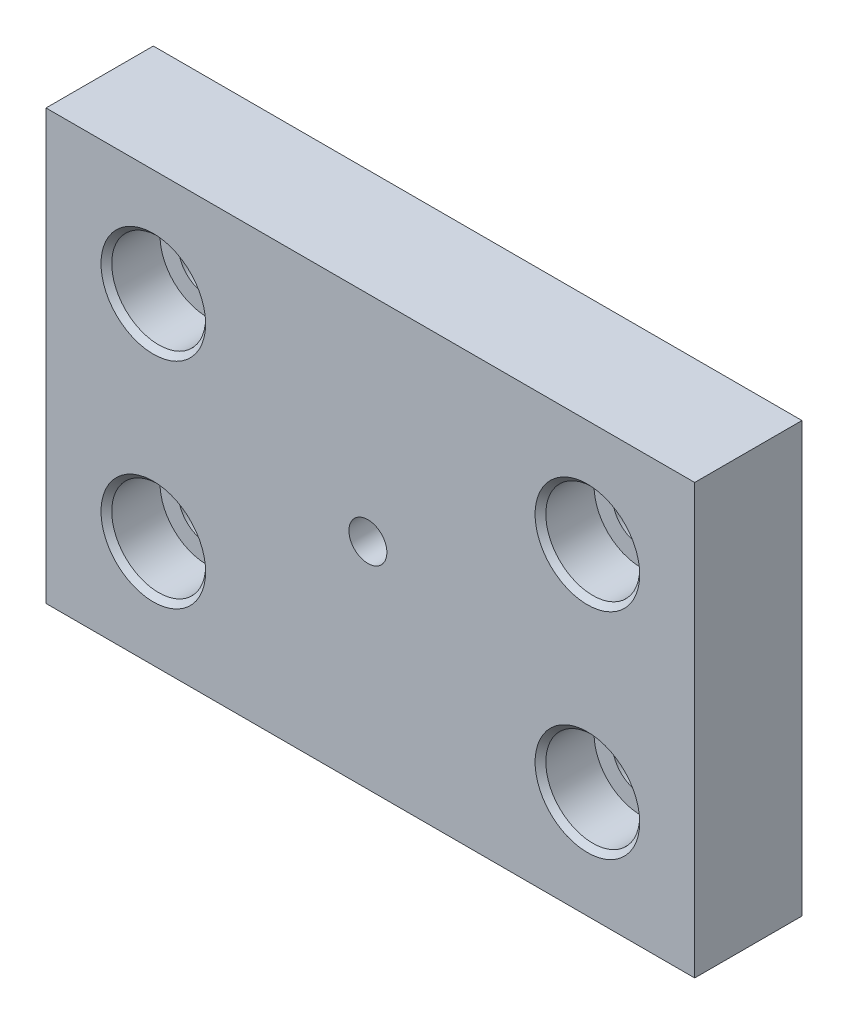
SolidWorks part; units mm, degrees
ref_plane "Front Plane" through (0, 0, 0) normal (0, 0, 1) x (1, 0, 0)
ref_plane "Top Plane" through (0, 0, 0) normal (0, 1, 0) x (1, 0, 0)
ref_plane "Right Plane" through (0, 0, 0) normal (1, 0, 0) x (0, 0, -1)
sketch "Sketch1" plane through (0, 0, 0) normal (0, 0, 1) x (1, 0, 0)
  line L1 (-57.2203, 29.3904) -> (19.5629, 29.3904)
  line L2 (-57.2203, 29.3904) -> (-57.2203, -21.4096)
  line L3 (-57.2203, -21.4096) -> (19.5629, -21.4096)
  line L4 (19.5629, 29.3904) -> (19.5629, -21.4096)
extrude "Boss-Extrude1" add sketch "Sketch1" along normal blind 12.7
hole_wizard "CBORE for 1/4 Socket Head Cap Screw1" positions "Sketch2" profile "Sketch3" counterbore size "1/4" standard "ANSI Inch"
sketch "Sketch2" plane through (0, 0, 12.7) normal (0, 0, 1) x (1, 0, 0)
  line L0 (19.5629, 29.3904) -> (-57.2203, 29.3904) construction
  line L1 (-57.2203, 29.3904) -> (-57.2203, -21.4096) construction
  line L2 (-57.2203, -21.4096) -> (19.5629, -21.4096) construction
  line L3 (19.5629, -21.4096) -> (19.5629, 29.3904) construction
  point P0 (-44.5203, 16.6904)
  point P2 (6.8629, 16.6904)
  point P4 (6.8629, -8.7096)
  point P6 (-44.5203, -8.7096)
  dimension "D1" = 12.7
  dimension "D2" = 12.7
  dimension "D3" = 12.7
  dimension "D4" = 12.7
  dimension "D5" = 12.7
  dimension "D6" = 12.7
  dimension "D7" = 12.7
  dimension "D8" = 12.7
sketch "Sketch3" plane through (-44.5203, 16.6904, 12.7) normal (1, 0, 0) x (0, -1, 0)
  line L0 (0, 0) -> (0, 12.7)
  line L1 (0, 12.7) -> (3.3782, 12.7)
  line L3 (3.3782, 12.7) -> (3.3782, 6.35)
  line L4 (5.5562, 6.35) -> (3.3782, 6.35)
  line L5 (5.5562, 6.35) -> (5.5562, 0.635)
  line L6 (5.5562, 0.635) -> (6.1912, 0)
  line L7 (6.1912, 0) -> (0, 0)
  line L8 (-5.5562, 0.635) -> (-6.1912, 0) construction
  line L11 (0, -6.35) -> (0, 107.95) construction
  dimension "Thru Hole Dia." = 6.7564
  dimension "Thru Hole Depth" = 12.7
  dimension "C'Bore Dia." = 11.1125
  dimension "C'Bore Depth" = 6.35
  dimension "Near C'Sink Dia." = 12.3825
  dimension "Near C'Sink Angle" = 90
hole_wizard "CBORE for #8 Socket Head Cap Screw1" positions "Sketch4" profile "Sketch5" counterbore size "#8" standard "ANSI Inch"
sketch "Sketch4" plane through (0, 0, 0) normal (0, 0, -1) x (-1, 0, 0)
  line L0 (-19.5629, 29.3904) -> (57.2203, 29.3904) construction
  line L1 (57.2203, 29.3904) -> (57.2203, -21.4096) construction
  point P0 (19.1203, 3.9904)
  dimension "D1" = 25.4
  dimension "D2" = 38.1
sketch "Sketch5" plane through (-19.1203, 3.9904, 0) normal (1, 0, 0) x (0, 1, 0)
  line L0 (0, 0) -> (0, 12.7)
  line L1 (0, 12.7) -> (2.2479, 12.7)
  line L3 (2.2479, 12.7) -> (2.2479, 4.1656)
  line L4 (3.9687, 4.1656) -> (2.2479, 4.1656)
  line L5 (3.9687, 4.1656) -> (3.9687, 0.635)
  line L6 (3.9687, 0.635) -> (4.6037, 0)
  line L7 (4.6037, 0) -> (0, 0)
  line L8 (-3.9687, 0.635) -> (-4.6037, 0) construction
  line L11 (0, -6.35) -> (0, 107.95) construction
  dimension "Thru Hole Dia." = 4.4958
  dimension "Thru Hole Depth" = 12.7
  dimension "C'Bore Dia." = 7.9375
  dimension "C'Bore Depth" = 4.1656
  dimension "Near C'Sink Dia." = 9.2075
  dimension "Near C'Sink Angle" = 90
